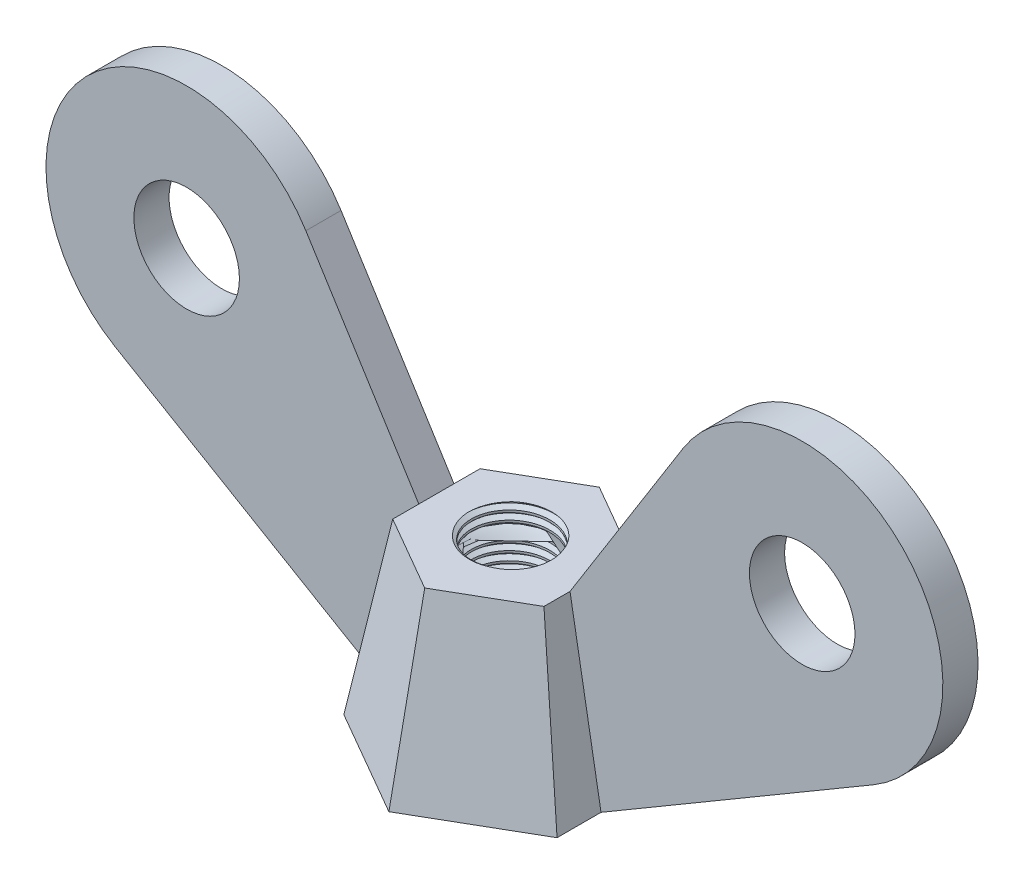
SolidWorks part; units mm, degrees
ref_plane "Front Plane" through (0, 0, 0) normal (0, 0, 1) x (1, 0, 0)
ref_plane "Top Plane" through (0, 0, 0) normal (0, 1, 0) x (1, 0, 0)
ref_plane "Right Plane" through (0, 0, 0) normal (1, 0, 0) x (0, 0, -1)
sketch "Sketch1" plane through (0, 0, 0) normal (0, 1, 0) x (1, 0, 0)
  line L1 (0, 14) -> (-12.1244, 7)
  line L2 (-12.1244, 7) -> (-12.1244, -7)
  line L3 (-12.1244, -7) -> (0, -14)
  line L4 (0, -14) -> (12.1244, -7)
  line L5 (12.1244, -7) -> (12.1244, 7)
  line L6 (12.1244, 7) -> (0, 14)
  circle A0 centre (0, 0) radius 12.1244 construction
  dimension "D1" = 14
extrude "Boss-Extrude1" add sketch "Sketch1" along normal blind 20 draft 10
sketch "Sketch2" plane through (0, 0, 0) normal (0, 0, 1) x (1, 0, 0)
  line L0 (-8.5978, 20) -> (-21.4422, 40.4963)
  line L1 (-43.106, 18.2053) -> (-12.1244, 0)
  line L2 (-12.1244, 0) -> (-8.5978, 20)
  arc A0 (-21.4422, 40.4963) -> (-43.106, 18.2053) centre (-35, 32) ccw
  circle A1 centre (-35, 32) radius 6
  dimension "D1" = 16
  dimension "D4" = 12
  dimension "D2" = 35
  dimension "D3" = 32
extrude "Boss-Extrude2" add sketch "Sketch2" along normal mid plane 4
mirror "Mirror1" about plane through (0, 0, 0) normal (1, 0, 0) of "Boss-Extrude2"
sketch "Sketch3" plane through (0, 20, 0) normal (0, 1, 0) x (1, 0, 0)
  circle A0 centre (0, 0) radius 5
  dimension "D1" = 10
extrude "Cut-Extrude1" cut sketch "Sketch3" against normal through all
thread "Thread1" pitch 1 start angle 0, offset 1, length 0, pitch 1, diameter 10
ref_plane "Plane2" through (-5, 21, 0) normal (0, 0, 1) x (-1, 0, 0)
sketch "Thread Profile2" plane through (-5, 21, 0) normal (0, 0, 1) x (-1, 0, 0)
  line L0 (0, 0) -> (0, 1) construction
  line L11 (0, 0) -> (0, 0.875)
  line L12 (0, 0.875) -> (-0.5413, 0.5625)
  line L13 (-0.5413, 0.5625) -> (-0.5413, 0.3125)
  line L15 (-0.5413, 0.3125) -> (0, 0)
  line L17 (-0.5413, 0.4375) -> (0, 0.4375) construction
  point P2 (0, 0)
  dimension "Pitch" = 1
  dimension "Profile_Angle" = 60
  dimension "Profile_Land" = 0.25
  dimension "Profile_Height" = 0.5413
